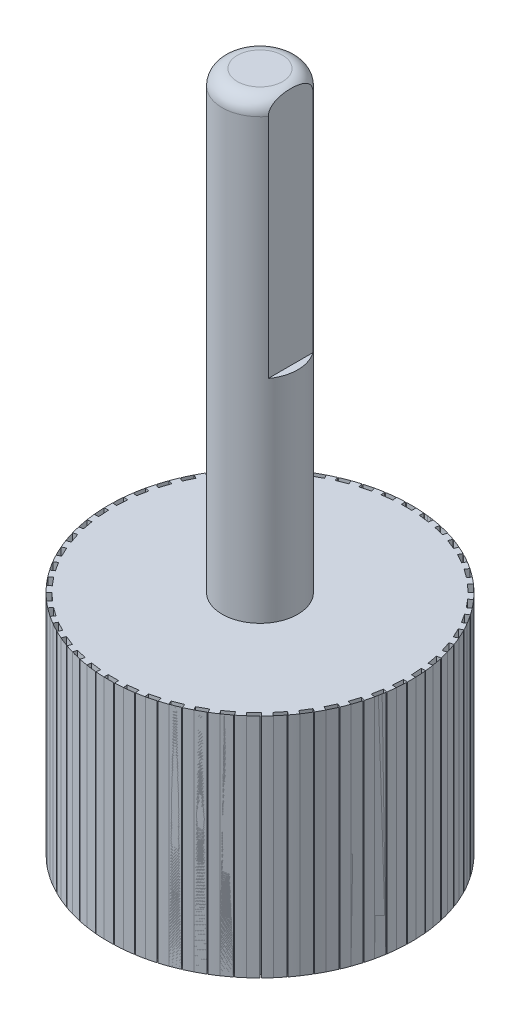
SolidWorks part; units mm, degrees
ref_plane "Ebene vorne" through (0, 0, 0) normal (0, 0, 1) x (1, 0, 0)
ref_plane "Ebene oben" through (0, 0, 0) normal (0, 1, 0) x (1, 0, 0)
ref_plane "Ebene rechts" through (0, 0, 0) normal (1, 0, 0) x (0, 0, -1)
sketch "Skizze1" plane through (0, 0, 0) normal (0, 1, 0) x (1, 0, 0)
  circle A0 centre (0, 0) radius 2.5
  dimension "D1" = 5
extrude "Aufsatz-Linear austragen1" add sketch "Skizze1" along normal blind 30
sketch "Skizze2" plane through (0, 30, 0) normal (0, 1, 0) x (1, 0, 0)
  line L1 (2.02, 1.473) -> (2.5, 1.473)
  line L2 (2.02, 1.473) -> (2.02, -1.6504)
  line L3 (2.02, -1.6504) -> (2.5, -1.6504)
  line L4 (2.5, 1.473) -> (2.5, -1.6504)
  circle A0 centre (0, 0) radius 2.5 construction
  dimension "D1" = 0.48
  dimension "D2" = 2.02
extrude "Schnitt-Linear austragen1" cut sketch "Skizze2" against normal blind 16
sketch "Skizze3" plane through (0, 0, 0) normal (0, -1, 0) x (1, 0, 0)
  circle A0 centre (0, 0) radius 10
  dimension "D1" = 20
extrude "Aufsatz-Linear austragen2" add sketch "Skizze3" along normal blind 15
sketch "Skizze4" plane through (0, -15, 0) normal (0, -1, 0) x (1, 0, 0)
  line L0 (0.9346, 9.9562) -> (1.6248, 9.869)
  line L1 (-0.3206, 9.9949) -> (0.3751, 9.9949)
  line L2 (-0.3206, 9.9949) -> (-0.3206, 9.7181)
  line L3 (-0.3206, 9.7181) -> (0.3751, 9.7181)
  line L4 (0.3751, 9.9949) -> (0.3751, 9.7181)
  line L5 (0.9346, 9.9562) -> (0.8999, 9.6816)
  line L6 (0.8999, 9.6816) -> (1.5901, 9.5944)
  line L7 (1.6248, 9.869) -> (1.5901, 9.5944)
  line L8 (2.1751, 9.7606) -> (2.8489, 9.5876)
  line L9 (2.1751, 9.7606) -> (2.1063, 9.4925)
  line L10 (2.1063, 9.4925) -> (2.7801, 9.3195)
  line L11 (2.8489, 9.5876) -> (2.7801, 9.3195)
  line L12 (3.3813, 9.411) -> (4.0281, 9.1549)
  line L13 (3.3813, 9.411) -> (3.2794, 9.1536)
  line L14 (3.2794, 9.1536) -> (3.9262, 8.8975)
  line L15 (4.0281, 9.1549) -> (3.9262, 8.8975)
  line L16 (4.5341, 8.913) -> (5.1438, 8.5779)
  line L17 (4.5341, 8.913) -> (4.4008, 8.6704)
  line L18 (4.4008, 8.6704) -> (5.0104, 8.3353)
  line L19 (5.1438, 8.5779) -> (5.0104, 8.3353)
  line L20 (5.6155, 8.2744) -> (6.1783, 7.8655)
  line L21 (5.6155, 8.2744) -> (5.4528, 8.0505)
  line L22 (5.4528, 8.0505) -> (6.0156, 7.6416)
  line L23 (6.1783, 7.8655) -> (6.0156, 7.6416)
  line L24 (6.6083, 7.5054) -> (7.1154, 7.0292)
  line L25 (6.6083, 7.5054) -> (6.4188, 7.3036)
  line L26 (6.4188, 7.3036) -> (6.9259, 6.8274)
  line L27 (7.1154, 7.0292) -> (6.9259, 6.8274)
  line L28 (7.4968, 6.618) -> (7.9403, 6.0819)
  line L29 (7.4968, 6.618) -> (7.2835, 6.4415)
  line L30 (7.2835, 6.4415) -> (7.727, 5.9055)
  line L31 (7.9403, 6.0819) -> (7.727, 5.9055)
  line L32 (8.2672, 5.6262) -> (8.6399, 5.0388)
  line L33 (8.2672, 5.6262) -> (8.0334, 5.4779)
  line L34 (8.0334, 5.4779) -> (8.4062, 4.8905)
  line L35 (8.6399, 5.0388) -> (8.4062, 4.8905)
  line L36 (8.9071, 4.5457) -> (9.2033, 3.9162)
  line L37 (8.9071, 4.5457) -> (8.6567, 4.4278)
  line L38 (8.6567, 4.4278) -> (8.9529, 3.7983)
  line L39 (9.2033, 3.9162) -> (8.9529, 3.7983)
  line L40 (9.4066, 3.3935) -> (9.6216, 2.7318)
  line L41 (9.4066, 3.3935) -> (9.1434, 3.3079)
  line L42 (9.1434, 3.3079) -> (9.3583, 2.6463)
  line L43 (9.6216, 2.7318) -> (9.3583, 2.6463)
  line L44 (9.7578, 2.1878) -> (9.8881, 1.5044)
  line L45 (9.7578, 2.1878) -> (9.4859, 2.1359)
  line L46 (9.4859, 2.1359) -> (9.6162, 1.4525)
  line L47 (9.8881, 1.5044) -> (9.6162, 1.4525)
  line L48 (9.955, 0.9475) -> (9.9987, 0.2532)
  line L49 (9.955, 0.9475) -> (9.6788, 0.9302)
  line L50 (9.6788, 0.9302) -> (9.7224, 0.2358)
  line L51 (9.9987, 0.2532) -> (9.7224, 0.2358)
  line L52 (9.9953, -0.3076) -> (9.9516, -1.0019)
  line L53 (9.9953, -0.3076) -> (9.719, -0.2902)
  line L54 (9.719, -0.2902) -> (9.6753, -0.9846)
  line L55 (9.9516, -1.0019) -> (9.6753, -0.9846)
  line L56 (9.8779, -1.5579) -> (9.7475, -2.2413)
  line L57 (9.8779, -1.5579) -> (9.606, -1.5061)
  line L58 (9.606, -1.5061) -> (9.4756, -2.1894)
  line L59 (9.7475, -2.2413) -> (9.4756, -2.1894)
  line L60 (9.6047, -2.7837) -> (9.3898, -3.4453)
  line L61 (9.6047, -2.7837) -> (9.3415, -2.6982)
  line L62 (9.3415, -2.6982) -> (9.1265, -3.3598)
  line L63 (9.3898, -3.4453) -> (9.1265, -3.3598)
  line L64 (9.1801, -3.9655) -> (8.8839, -4.595)
  line L65 (9.1801, -3.9655) -> (8.9297, -3.8477)
  line L66 (8.9297, -3.8477) -> (8.6334, -4.4772)
  line L67 (8.8839, -4.595) -> (8.6334, -4.4772)
  line L68 (8.6107, -5.0848) -> (8.2379, -5.6722)
  line L69 (8.6107, -5.0848) -> (8.377, -4.9365)
  line L70 (8.377, -4.9365) -> (8.0042, -5.5239)
  line L71 (8.2379, -5.6722) -> (8.0042, -5.5239)
  line L72 (7.9055, -6.1239) -> (7.4621, -6.66)
  line L73 (7.9055, -6.1239) -> (7.6922, -5.9475)
  line L74 (7.6922, -5.9475) -> (7.2488, -6.4835)
  line L75 (7.4621, -6.66) -> (7.2488, -6.4835)
  line L76 (7.0756, -7.0665) -> (6.5685, -7.5427)
  line L77 (7.0756, -7.0665) -> (6.8862, -6.8647)
  line L78 (6.8862, -6.8647) -> (6.379, -7.3409)
  line L79 (6.5685, -7.5427) -> (6.379, -7.3409)
  line L80 (6.1342, -7.8976) -> (5.5714, -8.3065)
  line L81 (6.1342, -7.8976) -> (5.9715, -7.6736)
  line L82 (5.9715, -7.6736) -> (5.4087, -8.0826)
  line L83 (5.5714, -8.3065) -> (5.4087, -8.0826)
  line L84 (5.096, -8.6041) -> (4.4864, -8.9393)
  line L85 (5.096, -8.6041) -> (4.9626, -8.3616)
  line L86 (4.9626, -8.3616) -> (4.353, -8.6967)
  line L87 (4.4864, -8.9393) -> (4.353, -8.6967)
  line L88 (3.9774, -9.175) -> (3.3306, -9.4311)
  line L89 (3.9774, -9.175) -> (3.8755, -8.9176)
  line L90 (3.8755, -8.9176) -> (3.2287, -9.1737)
  line L91 (3.3306, -9.4311) -> (3.2287, -9.1737)
  line L92 (2.7961, -9.6011) -> (2.1223, -9.7741)
  line L93 (2.7961, -9.6011) -> (2.7273, -9.333)
  line L94 (2.7273, -9.333) -> (2.0535, -9.506)
  line L95 (2.1223, -9.7741) -> (2.0535, -9.506)
  line L96 (1.5707, -9.8759) -> (0.8805, -9.9631)
  line L97 (1.5707, -9.8759) -> (1.5361, -9.6012)
  line L98 (1.5361, -9.6012) -> (0.8458, -9.6884)
  line L99 (0.8805, -9.9631) -> (0.8458, -9.6884)
  line L100 (0.3206, -9.9949) -> (-0.3751, -9.9949)
  line L101 (0.3206, -9.9949) -> (0.3206, -9.7181)
  line L102 (0.3206, -9.7181) -> (-0.3751, -9.7181)
  line L103 (-0.3751, -9.9949) -> (-0.3751, -9.7181)
  line L104 (-0.9346, -9.9562) -> (-1.6248, -9.869)
  line L105 (-0.9346, -9.9562) -> (-0.8999, -9.6816)
  line L106 (-0.8999, -9.6816) -> (-1.5901, -9.5944)
  line L107 (-1.6248, -9.869) -> (-1.5901, -9.5944)
  line L108 (-2.1751, -9.7606) -> (-2.8489, -9.5876)
  line L109 (-2.1751, -9.7606) -> (-2.1063, -9.4925)
  line L110 (-2.1063, -9.4925) -> (-2.7801, -9.3195)
  line L111 (-2.8489, -9.5876) -> (-2.7801, -9.3195)
  line L112 (-3.3813, -9.411) -> (-4.0281, -9.1549)
  line L113 (-3.3813, -9.411) -> (-3.2794, -9.1536)
  line L114 (-3.2794, -9.1536) -> (-3.9262, -8.8975)
  line L115 (-4.0281, -9.1549) -> (-3.9262, -8.8975)
  line L116 (-4.5341, -8.913) -> (-5.1438, -8.5779)
  line L117 (-4.5341, -8.913) -> (-4.4008, -8.6704)
  line L118 (-4.4008, -8.6704) -> (-5.0104, -8.3353)
  line L119 (-5.1438, -8.5779) -> (-5.0104, -8.3353)
  line L120 (-5.6155, -8.2744) -> (-6.1783, -7.8655)
  line L121 (-5.6155, -8.2744) -> (-5.4528, -8.0505)
  line L122 (-5.4528, -8.0505) -> (-6.0156, -7.6416)
  line L123 (-6.1783, -7.8655) -> (-6.0156, -7.6416)
  line L124 (-6.6083, -7.5054) -> (-7.1154, -7.0292)
  line L125 (-6.6083, -7.5054) -> (-6.4188, -7.3036)
  line L126 (-6.4188, -7.3036) -> (-6.9259, -6.8274)
  line L127 (-7.1154, -7.0292) -> (-6.9259, -6.8274)
  line L128 (-7.4968, -6.618) -> (-7.9403, -6.0819)
  line L129 (-7.4968, -6.618) -> (-7.2835, -6.4415)
  line L130 (-7.2835, -6.4415) -> (-7.727, -5.9055)
  line L131 (-7.9403, -6.0819) -> (-7.727, -5.9055)
  line L132 (-8.2672, -5.6262) -> (-8.6399, -5.0388)
  line L133 (-8.2672, -5.6262) -> (-8.0334, -5.4779)
  line L134 (-8.0334, -5.4779) -> (-8.4062, -4.8905)
  line L135 (-8.6399, -5.0388) -> (-8.4062, -4.8905)
  line L136 (-8.9071, -4.5457) -> (-9.2033, -3.9162)
  line L137 (-8.9071, -4.5457) -> (-8.6567, -4.4278)
  line L138 (-8.6567, -4.4278) -> (-8.9529, -3.7983)
  line L139 (-9.2033, -3.9162) -> (-8.9529, -3.7983)
  line L140 (-9.4066, -3.3935) -> (-9.6216, -2.7318)
  line L141 (-9.4066, -3.3935) -> (-9.1434, -3.3079)
  line L142 (-9.1434, -3.3079) -> (-9.3583, -2.6463)
  line L143 (-9.6216, -2.7318) -> (-9.3583, -2.6463)
  line L144 (-9.7578, -2.1878) -> (-9.8881, -1.5044)
  line L145 (-9.7578, -2.1878) -> (-9.4859, -2.1359)
  line L146 (-9.4859, -2.1359) -> (-9.6162, -1.4525)
  line L147 (-9.8881, -1.5044) -> (-9.6162, -1.4525)
  line L148 (-9.955, -0.9475) -> (-9.9987, -0.2532)
  line L149 (-9.955, -0.9475) -> (-9.6788, -0.9302)
  line L150 (-9.6788, -0.9302) -> (-9.7224, -0.2358)
  line L151 (-9.9987, -0.2532) -> (-9.7224, -0.2358)
  line L152 (-9.9953, 0.3076) -> (-9.9516, 1.0019)
  line L153 (-9.9953, 0.3076) -> (-9.719, 0.2902)
  line L154 (-9.719, 0.2902) -> (-9.6753, 0.9846)
  line L155 (-9.9516, 1.0019) -> (-9.6753, 0.9846)
  line L156 (-9.8779, 1.5579) -> (-9.7475, 2.2413)
  line L157 (-9.8779, 1.5579) -> (-9.606, 1.5061)
  line L158 (-9.606, 1.5061) -> (-9.4756, 2.1894)
  line L159 (-9.7475, 2.2413) -> (-9.4756, 2.1894)
  line L160 (-9.6047, 2.7837) -> (-9.3898, 3.4453)
  line L161 (-9.6047, 2.7837) -> (-9.3415, 2.6982)
  line L162 (-9.3415, 2.6982) -> (-9.1265, 3.3598)
  line L163 (-9.3898, 3.4453) -> (-9.1265, 3.3598)
  line L164 (-9.1801, 3.9655) -> (-8.8839, 4.595)
  line L165 (-9.1801, 3.9655) -> (-8.9297, 3.8477)
  line L166 (-8.9297, 3.8477) -> (-8.6334, 4.4772)
  line L167 (-8.8839, 4.595) -> (-8.6334, 4.4772)
  line L168 (-8.6107, 5.0848) -> (-8.2379, 5.6722)
  line L169 (-8.6107, 5.0848) -> (-8.377, 4.9365)
  line L170 (-8.377, 4.9365) -> (-8.0042, 5.5239)
  line L171 (-8.2379, 5.6722) -> (-8.0042, 5.5239)
  line L172 (-7.9055, 6.1239) -> (-7.4621, 6.66)
  line L173 (-7.9055, 6.1239) -> (-7.6922, 5.9475)
  line L174 (-7.6922, 5.9475) -> (-7.2488, 6.4835)
  line L175 (-7.4621, 6.66) -> (-7.2488, 6.4835)
  line L176 (-7.0756, 7.0665) -> (-6.5685, 7.5427)
  line L177 (-7.0756, 7.0665) -> (-6.8862, 6.8647)
  line L178 (-6.8862, 6.8647) -> (-6.379, 7.3409)
  line L179 (-6.5685, 7.5427) -> (-6.379, 7.3409)
  line L180 (-6.1342, 7.8976) -> (-5.5714, 8.3065)
  line L181 (-6.1342, 7.8976) -> (-5.9715, 7.6736)
  line L182 (-5.9715, 7.6736) -> (-5.4087, 8.0826)
  line L183 (-5.5714, 8.3065) -> (-5.4087, 8.0826)
  line L184 (-5.096, 8.6041) -> (-4.4864, 8.9393)
  line L185 (-5.096, 8.6041) -> (-4.9626, 8.3616)
  line L186 (-4.9626, 8.3616) -> (-4.353, 8.6967)
  line L187 (-4.4864, 8.9393) -> (-4.353, 8.6967)
  line L188 (-3.9774, 9.175) -> (-3.3306, 9.4311)
  line L189 (-3.9774, 9.175) -> (-3.8755, 8.9176)
  line L190 (-3.8755, 8.9176) -> (-3.2287, 9.1737)
  line L191 (-3.3306, 9.4311) -> (-3.2287, 9.1737)
  line L192 (-2.7961, 9.6011) -> (-2.1223, 9.7741)
  line L193 (-2.7961, 9.6011) -> (-2.7273, 9.333)
  line L194 (-2.7273, 9.333) -> (-2.0535, 9.506)
  line L195 (-2.1223, 9.7741) -> (-2.0535, 9.506)
  line L196 (-1.5707, 9.8759) -> (-0.8805, 9.9631)
  line L197 (-1.5707, 9.8759) -> (-1.5361, 9.6012)
  line L198 (-1.5361, 9.6012) -> (-0.8458, 9.6884)
  line L199 (-0.8805, 9.9631) -> (-0.8458, 9.6884)
  circle A0 centre (0, 0) radius 10 construction
  point P205 (0, 0)
extrude "Schnitt-Linear austragen2" cut sketch "Skizze4" against normal blind 15
fillet "Verrundung2" radius 1 1 edges at (-2.5, 30, 0)
